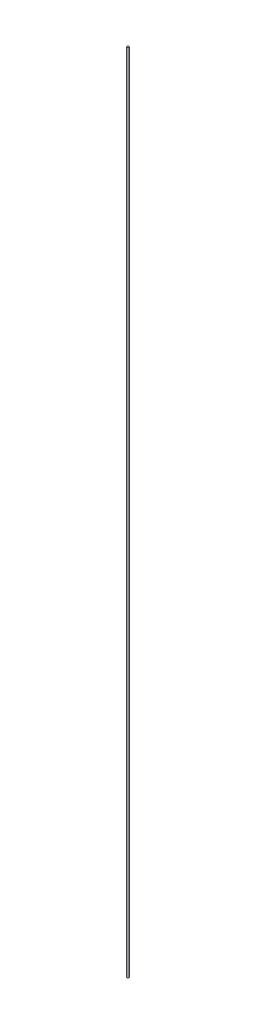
SolidWorks part; units mm, degrees
ref_plane "Front Plane" through (0, 0, 0) normal (0, 0, 1) x (1, 0, 0)
ref_plane "Top Plane" through (0, 0, 0) normal (0, 1, 0) x (1, 0, 0)
ref_plane "Right Plane" through (0, 0, 0) normal (1, 0, 0) x (0, 0, -1)
sketch "Sketch1" plane through (0, 0, 0) normal (0, 1, 0) x (1, 0, 0)
  circle A0 centre (0, 0) radius 0.25
  dimension "D1" = 0.5
extrude "Boss-Extrude1" add sketch "Sketch1" along normal blind 197
